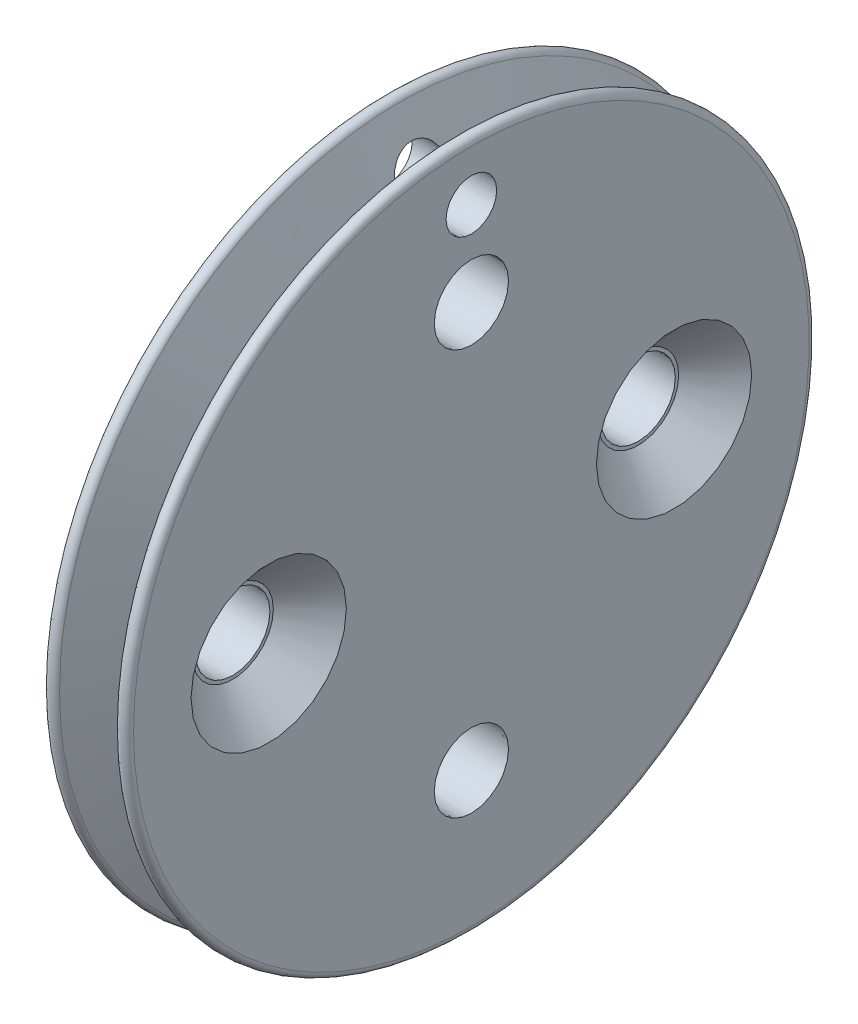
SolidWorks part; units mm, degrees
ref_plane "Ebene vorne" through (0, 0, 0) normal (0, 0, 1) x (1, 0, 0)
ref_plane "Ebene oben" through (0, 0, 0) normal (0, 1, 0) x (1, 0, 0)
ref_plane "Ebene rechts" through (0, 0, 0) normal (1, 0, 0) x (0, 0, -1)
sketch "Skizze1" plane through (0, 0, 0) normal (0, 0, 1) x (1, 0, 0)
  line L0 (-1.25, 0) -> (-1.25, 11)
  line L1 (2.8413, 0) -> (-2.8413, 0) construction
  line L2 (-1.25, 11) -> (0, 8)
  line L3 (0, -6.05) -> (0, 6.05) construction
  line L4 (0, 8) -> (0, 0)
  line L5 (1.25, 0) -> (-1.25, 0)
  line L6 (1.25, 11) -> (0, 8)
  line L7 (1.25, 0) -> (1.25, 11)
  line L8 (-1.25, 0) -> (3.916, 0) construction
  dimension "D1" = 1.25
  dimension "D2" = 11
  dimension "D3" = 3
revolve "Rotation1" add sketch "Skizze1" angle 360 about L8
sketch "Skizze3" plane through (1.25, 0, 0) normal (1, 0, 0) x (0, 0, -1)
  line L0 (0, 0) -> (0, 11) construction
  line L1 (-3.4388, 11) -> (5.8265, 11) construction
  circle A0 centre (0, 6) radius 1.1
  circle A1 centre (6, 0) radius 1.1
  circle A2 centre (0, -6) radius 1.1
  circle A3 centre (-6, 0) radius 1.1
  circle A4 centre (0, 8.5) radius 0.75
  circle A6 centre (0, 0) radius 11 construction
  point P14 (0, 0)
  dimension "D1" = 2.2
  dimension "D4" = 1.5
  dimension "D2" = 6
  dimension "D5" = 2.5
  dimension "D3" = 4
extrude "Schnitt-Linear austragen1" cut sketch "Skizze3" against normal blind 10
fillet "Verrundung5" radius 0.2 3 edges at (-1.25, 0, 11) (0, -8, 0) (1.25, 0, 11)
other "ErweiterteBohrung1" parameters "D1"=0
sketch "Skizze6" plane through (1.25, 0, 0) normal (1, 0, 0) x (0, 0, -1)
  point P0 (-6, 0)
  point P3 (6, 0)
sketch "Skizze7" plane through (1.25, 0, 6) normal (0, 0, 1) x (0, 1, 0)
  line L0 (0, 0) -> (0, 1.0623)
  line L1 (0, -0.5) -> (0, 1.5) construction
  line L2 (2.3, 0) -> (1.2, 1.0623)
  line L3 (-2.3, 0) -> (-1.2, 1.0623) construction
  line L4 (0, 0) -> (2.3, 0)
  line L5 (1.2, 1.0623) -> (0, 1.0623)
  dimension "D1" = 1.0623
  dimension "D2" = 4.6
  dimension "D3" = 92
